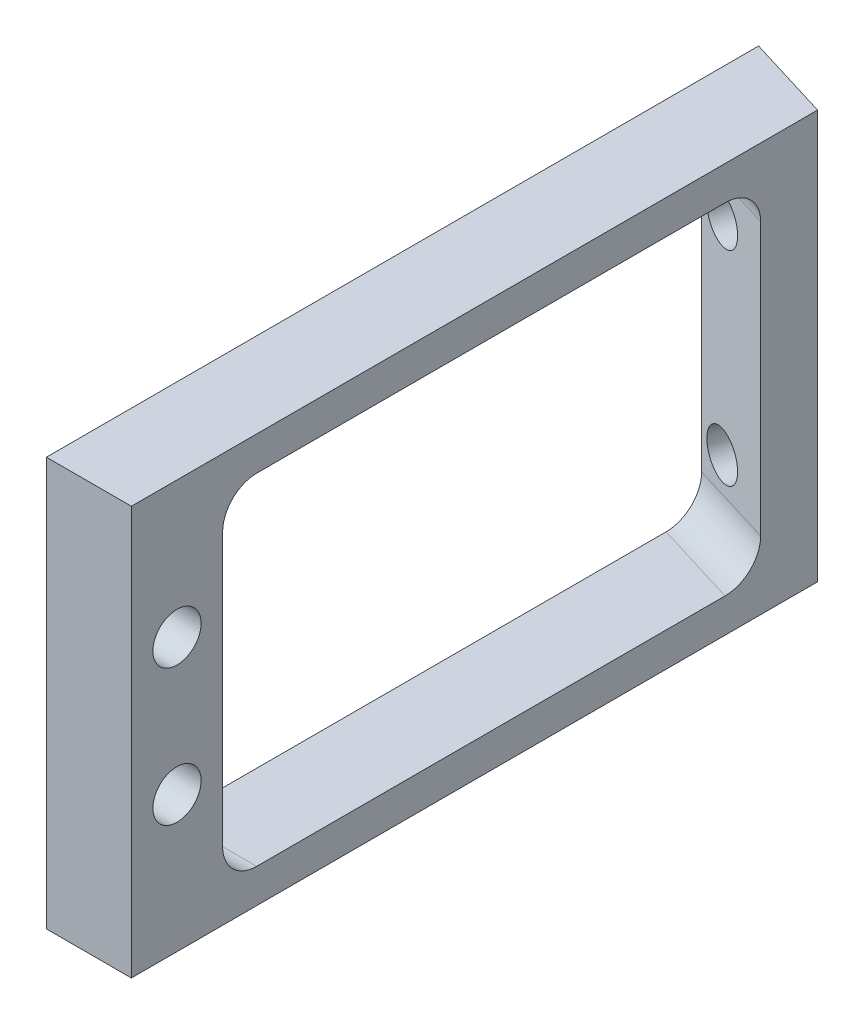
SolidWorks part; units mm, degrees
ref_plane "Front Plane" through (0, 0, 0) normal (0, 0, 1) x (1, 0, 0)
ref_plane "Top Plane" through (0, 0, 0) normal (0, 1, 0) x (1, 0, 0)
ref_plane "Right Plane" through (0, 0, 0) normal (1, 0, 0) x (0, 0, -1)
sketch "Sketch1" plane through (0, 0, 0) normal (1, 0, 0) x (0, 0, -1)
  line L1 (-66.421, 19.05) -> (0, 19.05)
  line L2 (-66.421, 19.05) -> (-66.421, -19.05)
  line L3 (-66.421, -19.05) -> (0, -19.05)
  line L4 (0, 19.05) -> (0, -19.05)
  point P4 (0, 0)
  dimension "D1" = 38.1
  dimension "D2" = 66.421
extrude "Extrude1" add sketch "Sketch1" along normal blind 7.9248
sketch "Sketch3" plane through (0, 19.05, 0) normal (0, 1, 0) x (-1, 0, 0)
  line L0 (0, 0) -> (-7.9248, 2.4229)
  line L1 (-7.9248, 0) -> (-7.9248, 66.421) construction
  line L2 (-7.9248, 2.4229) -> (-7.9248, 0)
  line L3 (-7.9248, 0) -> (0, 0)
  dimension "D1" = 17
extrude "Cut-Extrude2" cut sketch "Sketch3" against normal through all
sketch "Sketch4" plane through (0, 0, 0) normal (0.2924, 0, -0.9563) x (-0.9563, 0, -0.2924)
  line L0 (0, -19.05) -> (0, 19.05) construction
  circle A0 centre (-4.445, 9.525) radius 2.159
  circle A1 centre (-4.445, -9.525) radius 2.159
  dimension "D1" = 4.318
  dimension "D2" = 4.318
  dimension "D3" = 4.445
  dimension "D4" = 4.445
extrude "Cut-Extrude3" cut sketch "Sketch4" against normal through all
sketch "Sketch5" plane through (0, 0, 0) normal (-1, 0, 0) x (0, 0, 1)
  line L0 (0, -19.05) -> (0, 19.05) construction
  line L1 (11.303, 15.875) -> (54.737, 15.875)
  line L2 (8.128, 12.7) -> (8.128, -12.7)
  line L3 (11.303, -15.875) -> (54.737, -15.875)
  line L4 (57.912, 12.7) -> (57.912, -12.7)
  line L5 (66.421, 19.05) -> (66.421, -19.05) construction
  arc A0 (11.303, 15.875) -> (8.128, 12.7) centre (11.303, 12.7) ccw
  arc A1 (54.737, 15.875) -> (57.912, 12.7) centre (54.737, 12.7) cw
  arc A2 (54.737, -15.875) -> (57.912, -12.7) centre (54.737, -12.7) ccw
  arc A3 (8.128, -12.7) -> (11.303, -15.875) centre (11.303, -12.7) ccw
  point P13 (57.912, 15.875)
  point P16 (57.912, -15.875)
  dimension "D5" = 3.175
  dimension "D1" = 8.128
  dimension "D2" = 8.509
  dimension "D3" = 15.875
  dimension "D4" = 31.75
extrude "Cut-Extrude4" cut sketch "Sketch5" against normal through all
ref_plane "Plane1" through (0, 0, 0) normal (0.9563, 0, 0.2924) x (0.2924, 0, -0.9563)
sketch "Sketch6" plane through (0, 0, 0) normal (0.9563, 0, 0.2924) x (0.2924, 0, -0.9563)
  line L0 (-14.605, -15.875) -> (-8.255, -15.875)
  line L1 (-10.8091, -15.875) -> (-52.3453, -15.875) construction
  line L2 (-5.08, -12.7) -> (-5.08, 12.7)
  line L3 (-8.255, 15.875) -> (-14.605, 15.875)
  line L4 (-52.3453, 15.875) -> (-10.8091, 15.875) construction
  line L5 (-17.78, 12.7) -> (-17.78, -12.7)
  line L6 (0, -19.05) -> (0, 19.05) construction
  arc A0 (-14.605, -15.875) -> (-17.78, -12.7) centre (-14.605, -12.7) cw
  arc A1 (-8.255, -15.875) -> (-5.08, -12.7) centre (-8.255, -12.7) ccw
  arc A2 (-5.08, 12.7) -> (-8.255, 15.875) centre (-8.255, 12.7) ccw
  arc A3 (-14.605, 15.875) -> (-17.78, 12.7) centre (-14.605, 12.7) ccw
  point P12 (-17.78, -15.875)
  point P19 (-17.78, 15.875)
  dimension "D3" = 3.175
  dimension "D1" = 5.08
  dimension "D2" = 12.7
  dimension "D4" = 15.875
extrude "Cut-Extrude7" cut sketch "Sketch6" along normal through all
hole_wizard "#8 Clearance Hole1" positions "3DSketch1" profile "Sketch7" hole size "#8" standard "Ansi Inch"
sketch3d "3DSketch1"
  line L0 (0, 0, 0) -> (0, 0, 76.4342) construction
  line L2 (0, 19.05, 66.421) -> (0, -19.05, 66.421) construction
  point P0 (0, 6.35, 62.1665)
  point P2 (0, -6.35, 62.1665)
  dimension "D1" = 6.35
  dimension "D2" = 12.7
  dimension "D3" = 4.2545
sketch "Sketch7" plane through (0, 6.35, 62.1665) normal (0, 1, 0) x (0, 0, 1)
  line L0 (0, 0) -> (0, 7.9248)
  line L1 (0, 7.9248) -> (2.2479, 7.9248)
  line L2 (2.2479, 7.9248) -> (2.2479, 0)
  line L5 (2.2479, 0) -> (0, 0)
  line L11 (0, -6.35) -> (0, 107.95) construction
  dimension "Thru Hole Dia." = 4.4958
  dimension "Thru Hole Depth" = 7.9248
